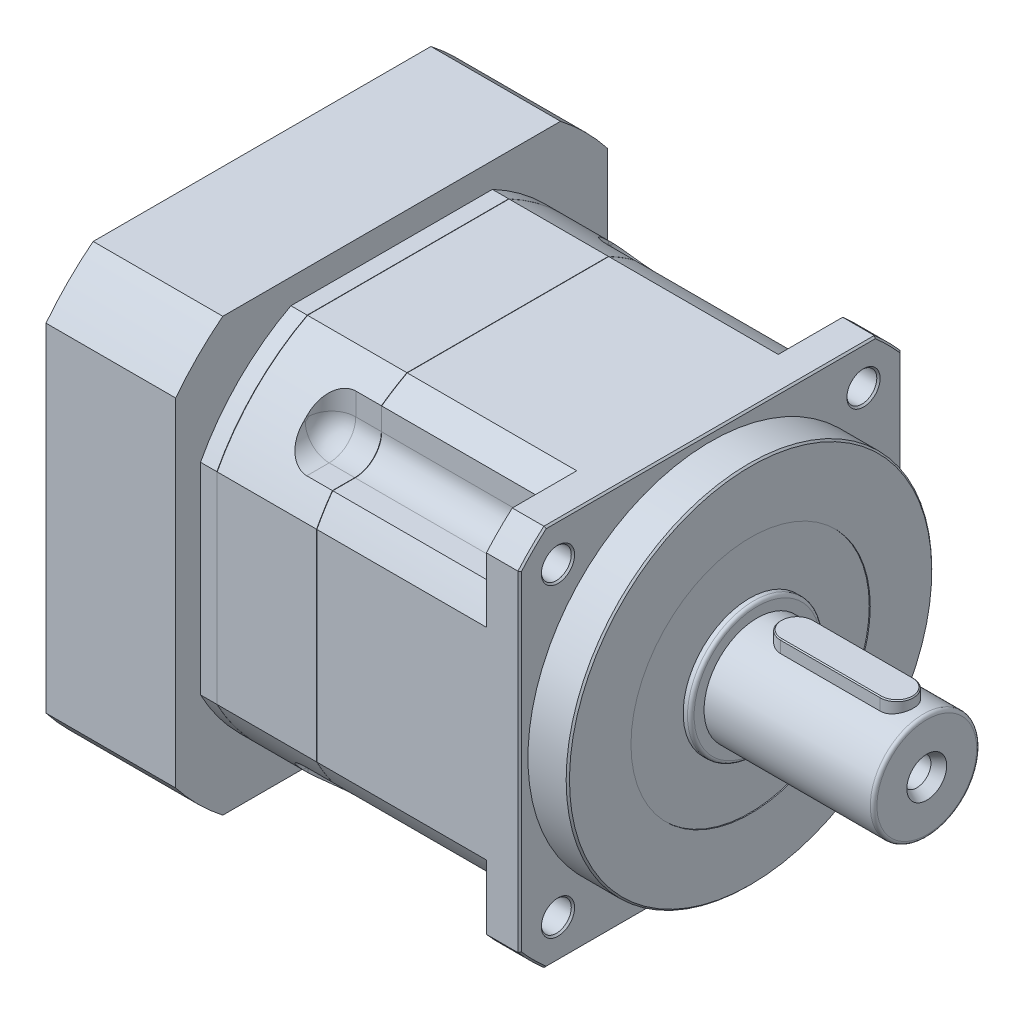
SolidWorks part; units mm, degrees
other "TeethCuts"
ref_plane "前视基准面" through (0, 0, 0) normal (0, 0, 1) x (1, 0, 0)
ref_plane "上视基准面" through (0, 0, 0) normal (0, 1, 0) x (1, 0, 0)
ref_plane "右视基准面" through (0, 0, 0) normal (1, 0, 0) x (0, 0, -1)
imported_body "输入1"
sketch "草图1" plane through (-16, 0, 0) normal (-1, 0, 0) x (0, 0, 1)
  circle A0 centre (0, 0) radius 53.7543
extrude "凸台-拉伸1" add sketch "草图1" against normal up to surface (61 mm away)
other "删除面1"
ref_plane "基准面1" through (-16.1, 0, 0) normal (-1, 0, 0) x (0, 0, 1)
sketch "草图3" plane through (-16.1, 0, 0) normal (-1, 0, 0) x (0, 0, 1)
  line L1 (-30.3109, 57.5) -> (30.3109, 57.5)
  line L2 (-57.5, 30.3109) -> (-57.5, -30.3109)
  line L3 (-30.3109, -57.5) -> (30.3109, -57.5)
  line L4 (57.5, 30.3109) -> (57.5, -30.3109)
  arc A0 (-30.3109, 57.5) -> (-57.5, 30.3109) centre (0, 0) ccw
  arc A1 (-57.5, -30.3109) -> (-30.3109, -57.5) centre (0, 0) ccw
  arc A2 (30.3109, -57.5) -> (57.5, -30.3109) centre (0, 0) ccw
  arc A3 (57.5, 30.3109) -> (30.3109, 57.5) centre (0, 0) ccw
  dimension "D1" = 57.5
  dimension "D3" = 57.5
extrude "凸台-拉伸2" add sketch "草图3" along normal blind 29.9 separate body
sketch "草图4" plane through (-16.1, 0, 0) normal (1, 0, 0) x (0, 0, -1)
  line L0 (38, 46) -> (38, 52.7352) construction
  line L1 (52.7352, 38) -> (46, 38) construction
  line L2 (38, 46) -> (38, 52.7352)
  line L3 (52.7352, 38) -> (46, 38)
  arc A0 (38, 46) -> (46, 38) centre (46, 46) ccw construction
  arc A1 (38, 46) -> (46, 38) centre (46, 46) ccw
  arc A2 (52.7352, 38) -> (38, 52.7352) centre (0, 0) ccw
extrude "切除-拉伸1" cut sketch "草图4" against normal blind 14.9
fillet "圆角1" radius 7.2 3 edges at (-31, 49.3676, -38) (-31, 38, -49.3676) (-31, 40.3431, -40.3431)
pattern_circular "阵列(圆周)1" count 4 over 360 about axis through (0, 0, 0) along (1, 0, 0) of "切除-拉伸1"
fillet "圆角2" radius 7.2 9 edges at (-31, -38, -49.3676) (-31, -49.3676, -38) (-31, -49.3676, 38) (-31, -38, 49.3676) (-31, 38, 49.3676) (-31, 49.3676, 38) (-31, -40.3431, -40.3431) (-31, -40.3431, 40.3431) (-31, 40.3431, 40.3431)
ref_plane "基准面2" through (-46.1, 0, 0) normal (-1, 0, 0) x (0, 0, 1)
sketch "草图5" plane through (-46.1, 0, 0) normal (-1, 0, 0) x (0, 0, 1)
  line L0 (30.3109, 57.5) -> (-30.3109, 57.5) construction
  line L1 (-57.5, 30.3109) -> (-57.5, -30.3109) construction
  line L2 (-30.3109, -57.5) -> (30.3109, -57.5) construction
  line L3 (57.5, -30.3109) -> (57.5, 30.3109) construction
  line L4 (30.3109, 57.5) -> (-30.3109, 57.5)
  line L5 (-57.5, 30.3109) -> (-57.5, -30.3109)
  line L6 (-30.3109, -57.5) -> (30.3109, -57.5)
  line L7 (57.5, -30.3109) -> (57.5, 30.3109)
  arc A0 (57.5, 30.3109) -> (30.3109, 57.5) centre (0, 0) ccw construction
  arc A1 (-30.3109, 57.5) -> (-57.5, 30.3109) centre (0, 0) ccw construction
  arc A2 (-57.5, -30.3109) -> (-30.3109, -57.5) centre (0, 0) ccw construction
  arc A3 (30.3109, -57.5) -> (57.5, -30.3109) centre (0, 0) ccw construction
  arc A4 (57.5, 30.3109) -> (30.3109, 57.5) centre (0, 0) ccw
  arc A5 (-30.3109, 57.5) -> (-57.5, 30.3109) centre (0, 0) ccw
  arc A6 (-57.5, -30.3109) -> (-30.3109, -57.5) centre (0, 0) ccw
  arc A7 (30.3109, -57.5) -> (57.5, -30.3109) centre (0, 0) ccw
extrude "凸台-拉伸3" add sketch "草图5" along normal blind 4.9 separate body
sketch "草图6" plane through (-51, 0, 0) normal (-1, 0, 0) x (0, 0, 1)
  line L1 (-50.806, 65) -> (50.806, 65)
  line L2 (-65, 50.806) -> (-65, -50.806)
  line L3 (-50.806, -65) -> (50.806, -65)
  line L4 (65, 50.806) -> (65, -50.806)
  arc A0 (-50.806, 65) -> (-65, 50.806) centre (0, 0) ccw
  arc A1 (-65, -50.806) -> (-50.806, -65) centre (0, 0) ccw
  arc A2 (50.806, -65) -> (65, -50.806) centre (0, 0) ccw
  arc A3 (65, 50.806) -> (50.806, 65) centre (0, 0) ccw
  dimension "D1" = 65
  dimension "D3" = 65
extrude "凸台-拉伸4" add sketch "草图6" along normal blind 39
sketch "草图7" plane through (-90, 0, 0) normal (-1, 0, 0) x (0, 0, 1)
  circle A0 centre (0, 0) radius 55
extrude "切除-拉伸2" cut sketch "草图7" against normal blind 11
sketch "草图8" plane through (-79, 0, 0) normal (-1, 0, 0) x (0, 0, 1)
  circle A0 centre (0, 0) radius 54.5
extrude "切除-拉伸3" cut sketch "草图8" against normal blind 8.5
sketch "草图9" plane through (-90, 0, 0) normal (-1, 0, 0) x (0, 0, 1)
  line L0 (0, 0) -> (-47.5, 0) construction
  circle A0 centre (0, 0) radius 47.5 construction
  circle A1 centre (-47.5, 0) radius 7
extrude "切除-拉伸4" cut sketch "草图9" against normal blind 32.5
pattern_circular "阵列(圆周)2" count 6 over 360 about axis through (0, 0, 0) along (1, 0, 0) of "切除-拉伸4"
sketch "草图10" plane through (-70.5, 0, 0) normal (-1, 0, 0) x (0, 0, 1)
  circle A0 centre (0, 0) radius 37
extrude "切除-拉伸5" cut sketch "草图10" against normal blind 20.5
ref_plane "基准面3" through (-70, 0, 0) normal (-1, 0, 0) x (0, 0, 1)
sketch "草图11" plane through (-70, 0, 0) normal (-1, 0, 0) x (0, 0, 1)
  circle A0 centre (0, 0) radius 32
extrude "凸台-拉伸5" add sketch "草图11" against normal up to surface (20 mm away)
chamfer "倒角1" distance 1 angle 45 1 edges at (-70, 0, 32)
sketch "草图12" plane through (-90, 0, 0) normal (-1, 0, 0) x (0, 0, 1)
  circle A0 centre (0, 0) radius 12
extrude "切除-拉伸6" cut sketch "草图12" against normal blind 65.5
sketch "草图13" plane through (-70, 0, 0) normal (-1, 0, 0) x (0, 0, 1)
  line L1 (-34.4407, 0.5) -> (34.1612, 0.5)
  line L2 (-34.4407, 0.5) -> (-34.4407, -0.5)
  line L3 (-34.4407, -0.5) -> (34.1612, -0.5)
  line L4 (34.1612, 0.5) -> (34.1612, -0.5)
  dimension "D1" = 0.5
  dimension "D2" = 1
extrude "切除-拉伸7" cut sketch "草图13" against normal up to surface (20 mm away)
sketch "草图14" plane through (45, 0, 0) normal (1, 0, 0) x (0, 0, -1)
  circle A0 centre (0, 0) radius 46.4321
extrude "凸台-拉伸6" add sketch "草图14" along normal up to surface (12 mm away)
sketch "草图15" plane through (-57.5, 0, 0) normal (-1, 0, 0) x (0, 0, 1)
  line L1 (-45.6347, 3.1089) -> (-49.2597, 3.1699)
  line L2 (-49.2597, 3.1699) -> (-51.125, 0.061)
  line L3 (-51.125, 0.061) -> (-49.3653, -3.1089)
  line L4 (-49.3653, -3.1089) -> (-45.7403, -3.1699)
  line L5 (-45.7403, -3.1699) -> (-43.875, -0.061)
  line L6 (-43.875, -0.061) -> (-45.6347, 3.1089)
  circle A0 centre (-47.5, 0) radius 6.5
  circle A1 centre (-47.5, 0) radius 3.1398 construction
extrude "凸台-拉伸7" add sketch "草图15" along normal blind 8
pattern_circular "阵列(圆周)3" count 6 over 360 about axis through (0, 0, 0) along (1, 0, 0) of "凸台-拉伸7"
sketch "草图16" plane through (-90, 0, 0) normal (-1, 0, 0) x (0, 0, 1)
  line L0 (0, 0) -> (-51.2652, 51.2652)
  circle A0 centre (0, 0) radius 72.5
hole_wizard "M8 螺纹孔1" positions "3D草图1" profile "草图17" tap size "M8" standard "GB"
sketch3d "3D草图1"
  point P0 (-90, 51.2652, -51.2652)
sketch "草图17" plane through (-90, 51.2652, -51.2652) normal (0, 1, 0) x (0, 0, 1)
  line L0 (0, 0) -> (0, 33.2929)
  line L1 (0, 33.2929) -> (3.4, 31.25)
  line L2 (3.4, 31.25) -> (3.4, 0)
  line L5 (3.4, 0) -> (0, 0)
  line L10 (0, 33.2929) -> (-3.4, 31.25) construction
  line L11 (0, -6.35) -> (0, 107.95) construction
  dimension "螺纹孔钻头直径" = 6.8
  dimension "螺纹孔钻头深度" = 31.25
  dimension "导头角度" = 118
pattern_circular "阵列(圆周)4" count 4 over 360 about axis through (0, 0, 0) along (1, 0, 0) of "M8 螺纹孔1"
sketch "草图18" plane through (57, 0, 0) normal (1, 0, 0) x (0, 0, -1)
  circle A0 centre (0, 0) radius 20
extrude "凸台-拉伸8" add sketch "草图18" along normal blind 2
fillet "圆角3" radius 1 1 edges at (59, 0, -20)
sketch "草图19" plane through (59, 0, 0) normal (1, 0, 0) x (0, 0, -1)
  circle A0 centre (0, 0) radius 16
extrude "凸台-拉伸9" add sketch "草图19" along normal blind 51
fillet "圆角4" radius 1 1 edges at (110, 0, -16)
sketch "草图20" plane through (57, 0, 0) normal (1, 0, 0) x (0, 0, -1)
  circle A0 centre (0, 0) radius 36
  circle A1 centre (0, 0) radius 20
extrude "切除-拉伸8" cut sketch "草图20" against normal blind 0.3
sketch "草图21" plane through (0, 0, 0) normal (0, 1, 0) x (1, 0, 0)
  line L0 (101, 5) -> (71, 5)
  line L1 (101, -5) -> (71, -5)
  line L2 (110, -15) -> (110, 15) construction
  arc A0 (101, -5) -> (101, 5) centre (101, 0) ccw
  arc A1 (71, 5) -> (71, -5) centre (71, 0) ccw
  dimension "D1" = 9
  dimension "D2" = 30
extrude "凸台-拉伸10" add sketch "草图21" along normal blind 19
chamfer "倒角2" distance 0.3 angle 45 4 edges at (66, 19, 0) (86, 19, 5) (86, 19, -5) (106, 19, 0)
sketch "草图23" plane through (110, 0, 0) normal (1, 0, 0) x (0, 0, -1)
  circle A0 centre (0, 0) radius 4.25
extrude "切除-拉伸9" cut sketch "草图23" against normal blind 8
ref_plane "基准面4" through (107, 0, 0) normal (1, 0, 0) x (0, 0, -1)
sketch "草图24" plane through (107, 0, 0) normal (1, 0, 0) x (0, 0, -1)
  circle A0 centre (0, 0) radius 4.25 construction
  circle A1 centre (0, 0) radius 4.25
sketch "草图25" plane through (110, 0, 0) normal (1, 0, 0) x (0, 0, -1)
  circle A0 centre (0, 0) radius 6
loft "切除-放样1" cut profiles "草图25", "草图24"
hole_wizard "M8 螺纹孔2" positions "3D草图2" profile "草图26" tap size "M8" standard "GB"
sketch3d "3D草图2"
  line L0 (102, 0, 0) -> (107, 0, 0) construction
  point P0 (102, 0, 0)
sketch "草图26" plane through (102, 0, 0) normal (0, 1, 0) x (0, 0, -1)
  line L0 (0, 0) -> (0, 22.0429)
  line L1 (0, 22.0429) -> (3.4, 20)
  line L2 (3.4, 20) -> (3.4, 0)
  line L5 (3.4, 0) -> (0, 0)
  line L10 (0, 22.0429) -> (-3.4, 20) construction
  line L11 (0, -6.35) -> (0, 107.95) construction
  dimension "螺纹孔钻头直径" = 6.8
  dimension "螺纹孔钻头深度" = 20
  dimension "导头角度" = 118
